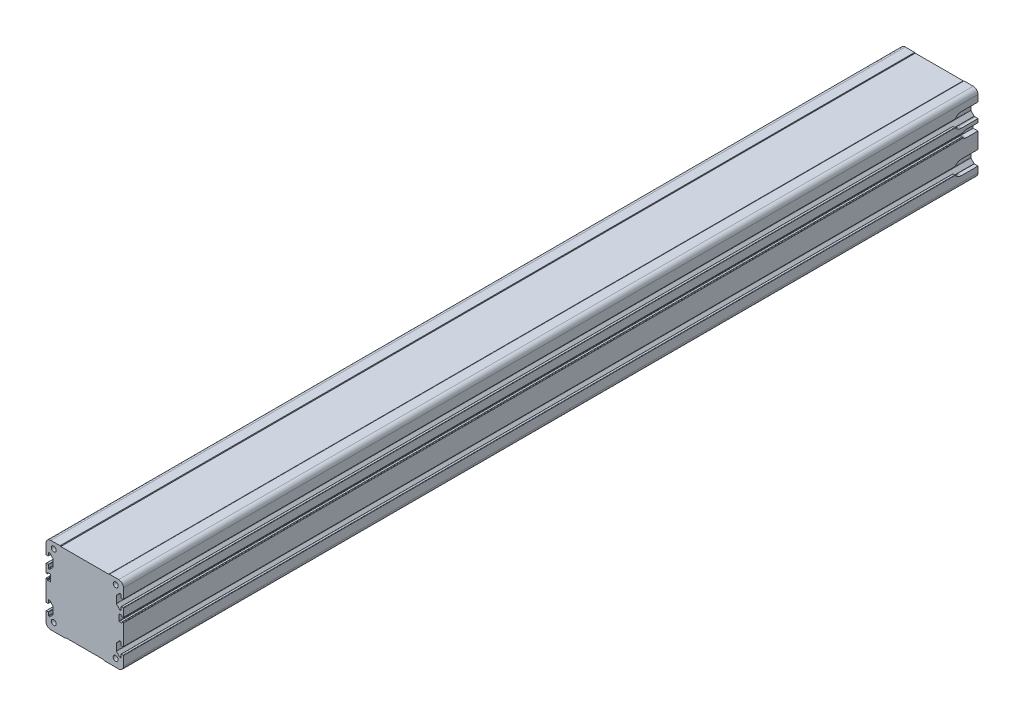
SolidWorks part; units mm, degrees
ref_plane "前视基准面" through (0, 0, 0) normal (0, 0, 1) x (1, 0, 0)
ref_plane "上视基准面" through (0, 0, 0) normal (0, 1, 0) x (1, 0, 0)
ref_plane "右视基准面" through (0, 0, 0) normal (1, 0, 0) x (0, 0, -1)
sketch "草图1" plane through (0, 0, 0) normal (0, 0, 1) x (1, 0, 0)
  line L32 (-20.2551, 64.27) -> (-20.5249, 64.43)
  line L33 (-20.78, 64.5) -> (-28.5, 64.5)
  line L34 (-32.5, 60.5) -> (-32.5, 52.3)
  line L35 (-32.2, 52) -> (-30.8, 52)
  line L36 (-30.5, 52.3) -> (-30.5, 54.7)
  line L37 (-30.2, 55) -> (-29.4379, 55)
  line L38 (-29.2188, 54.9049) -> (-26.6349, 52.1426)
  line L39 (-26.5, 51.801) -> (-26.5, 46.199)
  line L40 (-26.6349, 45.8574) -> (-29.2188, 43.0951)
  line L41 (-29.4379, 43) -> (-30.2, 43)
  line L42 (-30.5, 43.3) -> (-30.5, 45.7)
  line L43 (-30.8, 46) -> (-32.2, 46)
  line L44 (-32.5, 45.7) -> (-32.5, 39.044)
  line L45 (-32.2, 38.744) -> (-31.5, 38.744)
  line L46 (-31.2, 39.044) -> (-31.2, 39.544)
  line L47 (-30.9, 39.844) -> (-28.9, 39.844)
  line L48 (-28.6, 39.544) -> (-28.6, 34.444)
  line L49 (-28.9, 34.144) -> (-30.9, 34.144)
  line L50 (-31.2, 34.444) -> (-31.2, 34.944)
  line L51 (-31.5, 35.244) -> (-32.2, 35.244)
  line L52 (-32.5, 34.944) -> (-32.5, 17.8)
  line L53 (-32.2, 17.5) -> (-30.8, 17.5)
  line L54 (-30.5, 17.8) -> (-30.5, 20.2)
  line L55 (-30.2, 20.5) -> (-29.4379, 20.5)
  line L56 (-29.2188, 20.4049) -> (-26.6349, 17.6426)
  line L57 (-26.5, 17.301) -> (-26.5, 11.699)
  line L58 (-26.6349, 11.3574) -> (-29.2188, 8.5951)
  line L59 (-29.4379, 8.5) -> (-30.2, 8.5)
  line L60 (-30.5, 8.8) -> (-30.5, 11.2)
  line L61 (-30.8, 11.5) -> (-32.2, 11.5)
  line L62 (-32.5, 11.2) -> (-32.5, 3.5)
  line L63 (-28.5, -0.5) -> (-16.4822, -0.5)
  line L64 (-16.0411, -0.3975) -> (-15.4411, -0.1025)
  line L65 (-15, 0) -> (15, 0)
  line L66 (15.4411, -0.1025) -> (16.0411, -0.3975)
  line L67 (16.4822, -0.5) -> (28.5, -0.5)
  line L68 (32.5, 3.5) -> (32.5, 11.2)
  line L69 (32.2, 11.5) -> (30.8, 11.5)
  line L70 (30.5, 11.2) -> (30.5, 8.8)
  line L71 (30.2, 8.5) -> (29.4379, 8.5)
  line L72 (29.2188, 8.5951) -> (26.6349, 11.3574)
  line L73 (26.5, 11.699) -> (26.5, 17.301)
  line L74 (26.6349, 17.6426) -> (29.2188, 20.4049)
  line L75 (29.4379, 20.5) -> (30.2, 20.5)
  line L76 (30.5, 20.2) -> (30.5, 17.8)
  line L77 (30.8, 17.5) -> (32.2, 17.5)
  line L78 (32.5, 17.8) -> (32.5, 34.944)
  line L79 (32.2, 35.244) -> (31.5, 35.244)
  line L80 (31.2, 34.944) -> (31.2, 34.444)
  line L81 (30.9, 34.144) -> (28.9, 34.144)
  line L82 (28.6, 34.444) -> (28.6, 39.544)
  line L83 (28.9, 39.844) -> (30.9, 39.844)
  line L84 (31.2, 39.544) -> (31.2, 39.044)
  line L85 (31.5, 38.744) -> (32.2, 38.744)
  line L86 (32.5, 39.044) -> (32.5, 45.7)
  line L87 (32.2, 46) -> (30.8, 46)
  line L88 (30.5, 45.7) -> (30.5, 43.3)
  line L89 (30.2, 43) -> (29.4379, 43)
  line L90 (29.2188, 43.0951) -> (26.6349, 45.8574)
  line L91 (26.5, 46.199) -> (26.5, 51.801)
  line L92 (26.6349, 52.1426) -> (29.2188, 54.9049)
  line L93 (29.4379, 55) -> (30.2, 55)
  line L94 (30.5, 54.7) -> (30.5, 52.3)
  line L95 (30.8, 52) -> (32.2, 52)
  line L96 (32.5, 52.3) -> (32.5, 60.5)
  line L97 (28.5, 64.5) -> (20.78, 64.5)
  line L98 (20.5249, 64.43) -> (20.2551, 64.27)
  line L99 (20, 64.2) -> (-20, 64.2)
  arc A47 (-20.2551, 64.27) -> (-20, 64.2) centre (-20, 64.7) ccw
  arc A48 (-20.5249, 64.43) -> (-20.78, 64.5) centre (-20.78, 64) ccw
  arc A49 (-28.5, 64.5) -> (-32.5, 60.5) centre (-28.5, 60.5) ccw
  arc A50 (-32.5, 52.3) -> (-32.2, 52) centre (-32.2, 52.3) ccw
  arc A51 (-30.8, 52) -> (-30.5, 52.3) centre (-30.8, 52.3) ccw
  arc A52 (-30.2, 55) -> (-30.5, 54.7) centre (-30.2, 54.7) ccw
  arc A53 (-29.2188, 54.9049) -> (-29.4379, 55) centre (-29.4379, 54.7) ccw
  arc A54 (-26.5, 51.801) -> (-26.6349, 52.1426) centre (-27, 51.801) ccw
  arc A55 (-26.6349, 45.8574) -> (-26.5, 46.199) centre (-27, 46.199) ccw
  arc A56 (-29.4379, 43) -> (-29.2188, 43.0951) centre (-29.4379, 43.3) ccw
  arc A57 (-30.5, 43.3) -> (-30.2, 43) centre (-30.2, 43.3) ccw
  arc A58 (-30.5, 45.7) -> (-30.8, 46) centre (-30.8, 45.7) ccw
  arc A59 (-32.2, 46) -> (-32.5, 45.7) centre (-32.2, 45.7) ccw
  arc A60 (-32.5, 39.044) -> (-32.2, 38.744) centre (-32.2, 39.044) ccw
  arc A61 (-31.5, 38.744) -> (-31.2, 39.044) centre (-31.5, 39.044) ccw
  arc A62 (-30.9, 39.844) -> (-31.2, 39.544) centre (-30.9, 39.544) ccw
  arc A63 (-28.6, 39.544) -> (-28.9, 39.844) centre (-28.9, 39.544) ccw
  arc A64 (-28.9, 34.144) -> (-28.6, 34.444) centre (-28.9, 34.444) ccw
  arc A65 (-31.2, 34.444) -> (-30.9, 34.144) centre (-30.9, 34.444) ccw
  arc A66 (-31.2, 34.944) -> (-31.5, 35.244) centre (-31.5, 34.944) ccw
  arc A67 (-32.2, 35.244) -> (-32.5, 34.944) centre (-32.2, 34.944) ccw
  arc A68 (-32.5, 17.8) -> (-32.2, 17.5) centre (-32.2, 17.8) ccw
  arc A69 (-30.8, 17.5) -> (-30.5, 17.8) centre (-30.8, 17.8) ccw
  arc A70 (-30.2, 20.5) -> (-30.5, 20.2) centre (-30.2, 20.2) ccw
  arc A71 (-29.2188, 20.4049) -> (-29.4379, 20.5) centre (-29.4379, 20.2) ccw
  arc A72 (-26.5, 17.301) -> (-26.6349, 17.6426) centre (-27, 17.301) ccw
  arc A73 (-26.6349, 11.3574) -> (-26.5, 11.699) centre (-27, 11.699) ccw
  arc A74 (-29.4379, 8.5) -> (-29.2188, 8.5951) centre (-29.4379, 8.8) ccw
  arc A75 (-30.5, 8.8) -> (-30.2, 8.5) centre (-30.2, 8.8) ccw
  arc A76 (-30.5, 11.2) -> (-30.8, 11.5) centre (-30.8, 11.2) ccw
  arc A77 (-32.2, 11.5) -> (-32.5, 11.2) centre (-32.2, 11.2) ccw
  arc A78 (-32.5, 3.5) -> (-28.5, -0.5) centre (-28.5, 3.5) ccw
  arc A79 (-16.4822, -0.5) -> (-16.0411, -0.3975) centre (-16.4822, 0.5) ccw
  arc A80 (-15, 0) -> (-15.4411, -0.1025) centre (-15, -1) ccw
  arc A81 (15.4411, -0.1025) -> (15, 0) centre (15, -1) ccw
  arc A82 (16.0411, -0.3975) -> (16.4822, -0.5) centre (16.4822, 0.5) ccw
  arc A83 (28.5, -0.5) -> (32.5, 3.5) centre (28.5, 3.5) ccw
  arc A84 (32.5, 11.2) -> (32.2, 11.5) centre (32.2, 11.2) ccw
  arc A85 (30.8, 11.5) -> (30.5, 11.2) centre (30.8, 11.2) ccw
  arc A86 (30.2, 8.5) -> (30.5, 8.8) centre (30.2, 8.8) ccw
  arc A87 (29.2188, 8.5951) -> (29.4379, 8.5) centre (29.4379, 8.8) ccw
  arc A88 (26.5, 11.699) -> (26.6349, 11.3574) centre (27, 11.699) ccw
  arc A89 (26.6349, 17.6426) -> (26.5, 17.301) centre (27, 17.301) ccw
  arc A90 (29.4379, 20.5) -> (29.2188, 20.4049) centre (29.4379, 20.2) ccw
  arc A91 (30.5, 20.2) -> (30.2, 20.5) centre (30.2, 20.2) ccw
  arc A92 (30.5, 17.8) -> (30.8, 17.5) centre (30.8, 17.8) ccw
  arc A93 (32.2, 17.5) -> (32.5, 17.8) centre (32.2, 17.8) ccw
  arc A94 (32.5, 34.944) -> (32.2, 35.244) centre (32.2, 34.944) ccw
  arc A95 (31.5, 35.244) -> (31.2, 34.944) centre (31.5, 34.944) ccw
  arc A96 (30.9, 34.144) -> (31.2, 34.444) centre (30.9, 34.444) ccw
  arc A97 (28.6, 34.444) -> (28.9, 34.144) centre (28.9, 34.444) ccw
  arc A98 (28.9, 39.844) -> (28.6, 39.544) centre (28.9, 39.544) ccw
  arc A99 (31.2, 39.544) -> (30.9, 39.844) centre (30.9, 39.544) ccw
  arc A100 (31.2, 39.044) -> (31.5, 38.744) centre (31.5, 39.044) ccw
  arc A101 (32.2, 38.744) -> (32.5, 39.044) centre (32.2, 39.044) ccw
  arc A102 (32.5, 45.7) -> (32.2, 46) centre (32.2, 45.7) ccw
  arc A103 (30.8, 46) -> (30.5, 45.7) centre (30.8, 45.7) ccw
  arc A104 (30.2, 43) -> (30.5, 43.3) centre (30.2, 43.3) ccw
  arc A105 (29.2188, 43.0951) -> (29.4379, 43) centre (29.4379, 43.3) ccw
  arc A106 (26.5, 46.199) -> (26.6349, 45.8574) centre (27, 46.199) ccw
  arc A107 (26.6349, 52.1426) -> (26.5, 51.801) centre (27, 51.801) ccw
  arc A108 (29.4379, 55) -> (29.2188, 54.9049) centre (29.4379, 54.7) ccw
  arc A109 (30.5, 54.7) -> (30.2, 55) centre (30.2, 54.7) ccw
  arc A110 (30.5, 52.3) -> (30.8, 52) centre (30.8, 52.3) ccw
  arc A111 (32.2, 52) -> (32.5, 52.3) centre (32.2, 52.3) ccw
  arc A112 (32.5, 60.5) -> (28.5, 64.5) centre (28.5, 60.5) ccw
  arc A113 (20.78, 64.5) -> (20.5249, 64.43) centre (20.78, 64) ccw
  arc A114 (20, 64.2) -> (20.2551, 64.27) centre (20, 64.7) ccw
  point P409 (44.5533, -0.5)
  point P410 (28.6, 36.994)
  point P411 (32.5, 5.6537)
  point P412 (-32.5, 5.6537)
  point P413 (54.4473, -0.5)
  point P414 (27.0437, 64.5)
  dimension "D2" = 37.494
  dimension "D3" = 65
  dimension "D4" = 65
extrude "凸台-拉伸1" add sketch "草图1" along normal blind 717
sketch "草图2" plane through (-32.5, 0, 0) normal (-1, 0, 0) x (0, 0, 1)
  line L1 (0, 49) -> (23.136, 49) construction
  line L2 (0, 51.801) -> (0, 46.199) construction
  line L3 (0, 14.5) -> (24.037, 14.5) construction
  line L4 (0, 17.301) -> (0, 11.699) construction
  line L6 (0, 49) -> (14, 49) construction
  line L8 (0, 55) -> (14, 55)
  line L9 (0, 43) -> (14, 43)
  line L10 (0, 14.5) -> (14, 14.5) construction
  line L11 (0, 20.5) -> (14, 20.5)
  line L12 (0, 8.5) -> (14, 8.5)
  arc A0 (0, 55) -> (0, 43) centre (0, 49) ccw
  arc A1 (14, 43) -> (14, 55) centre (14, 49) ccw
  arc A2 (0, 20.5) -> (0, 8.5) centre (0, 14.5) ccw
  arc A3 (14, 8.5) -> (14, 20.5) centre (14, 14.5) ccw
  point P8 (7, 49)
  point P14 (7, 14.5)
  dimension "D1" = 12
  dimension "D2" = 14
extrude "切除-拉伸1" cut sketch "草图2" against normal blind 3
sketch "草图3" plane through (-32.5, 0, 0) normal (-1, 0, 0) x (0, 0, 1)
  line L0 (0, 36.994) -> (10, 36.994) construction
  line L1 (0, 39.544) -> (0, 34.444) construction
  line L2 (0, 39.994) -> (10, 39.994)
  line L3 (0, 33.994) -> (10, 33.994)
  arc A0 (0, 39.994) -> (0, 33.994) centre (0, 36.994) ccw
  arc A1 (10, 33.994) -> (10, 39.994) centre (10, 36.994) ccw
  point P4 (5, 36.994)
  dimension "D1" = 6
  dimension "D2" = 10
extrude "切除-拉伸2" cut sketch "草图3" against normal blind 4
mirror "镜向1" about plane through (0, 0, 0) normal (1, 0, 0) of "切除-拉伸1", "切除-拉伸2"
hole_wizard "M5 螺纹孔1" positions "草图4" profile "草图5" tap size "M5" standard "GB"
sketch "草图4" plane through (0, 0, 717) normal (0, 0, 1) x (1, 0, 0)
  line L3 (0, 0) -> (0, 64.2) construction
  line L4 (20, 64.2) -> (-20, 64.2) construction
  line L5 (-28.5, -0.5) -> (-16.4822, -0.5) construction
  line L6 (-20.78, 64.5) -> (-28.5, 64.5) construction
  point P15 (-26, 59.5)
  point P17 (-26, 6)
  point P24 (26, 6)
  point P25 (26, 59.5)
  dimension "D1" = 52
  dimension "D2" = 6.5
  dimension "D3" = 5
sketch "草图5" plane through (-26, 59.5, 717) normal (1, 0, 0) x (0, -1, 0)
  line L0 (0, 0) -> (0, 717)
  line L1 (0, 717) -> (2.1, 717)
  line L2 (2.1, 717) -> (2.1, 0)
  line L5 (2.1, 0) -> (0, 0)
  line L11 (0, -6.35) -> (0, 107.95) construction
  dimension "通孔螺纹孔钻头直径" = 4.2
  dimension "通孔螺纹孔钻头深度" = 717
